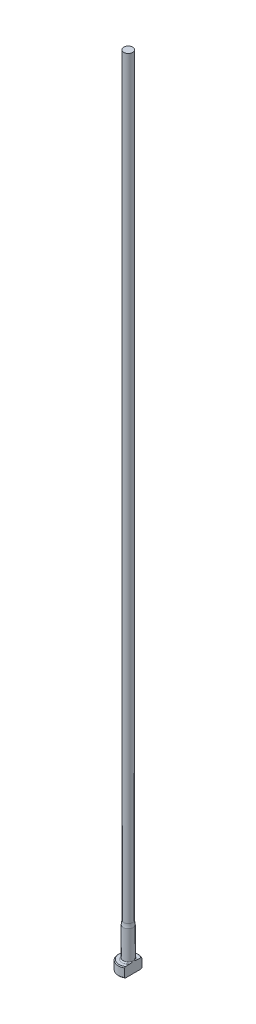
SolidWorks part; units mm, degrees
ref_plane "Front Plane" through (0, 0, 0) normal (0, 0, 1) x (1, 0, 0)
ref_plane "Top Plane" through (0, 0, 0) normal (0, 1, 0) x (1, 0, 0)
ref_plane "Right Plane" through (0, 0, 0) normal (1, 0, 0) x (0, 0, -1)
sketch "Sketch1" plane through (0, 0, 0) normal (0, 0, 1) x (1, 0, 0)
  line L0 (0, 259.9588) -> (0, -15.1925) construction
  line L1 (0, 0) -> (-3.175, 0)
  line L2 (-3.175, 0) -> (-3.175, 3.175)
  line L3 (-3.175, 3.175) -> (-1.5875, 3.175)
  line L4 (-1.4516, 14.0067) -> (-1.4516, 254)
  line L5 (-1.4516, 254) -> (0, 254)
  line L6 (0, 254) -> (0, 0)
  line L7 (-1.5875, 3.175) -> (-1.5875, 12.7)
  arc A0 (-1.5875, 12.7) -> (-1.4516, 14.0067) centre (-7.8016, 14.0067) ccw
  point P13 (-1.5875, 0)
  dimension "D1" = 6.35
  dimension "L" = 254
  dimension "D2" = 3.175
  dimension "H" = 6.35
  dimension "T" = 3.175
  dimension "D" = 2.9032
  dimension "S" = 12.7
revolve "Revolve1" add sketch "Sketch1" angle 360 about L0
chamfer "Chamfer1" distance 0.254 angle 45 2 edges at (0, 3.175, 3.175) (0, 0, 3.175)
fillet "Fillet1" radius 0.381 1 edges at (0, 3.175, 1.5875)
sketch "Sketch2" plane through (0, 0, 0) normal (0, 1, 0) x (1, 0, 0)
  line L0 (1.5875, -2.7496) -> (1.5875, 2.7496)
  circle A0 centre (0, 0) radius 3.175 construction
  arc A2 (1.5875, -2.7496) -> (1.5875, 2.7496) centre (0, 0) ccw
  circle A3 centre (0, 0) radius 3.175 construction
  circle A4 centre (0, 0) radius 1.5875 construction
extrude "Key Head" cut sketch "Sketch2" along normal up to next
